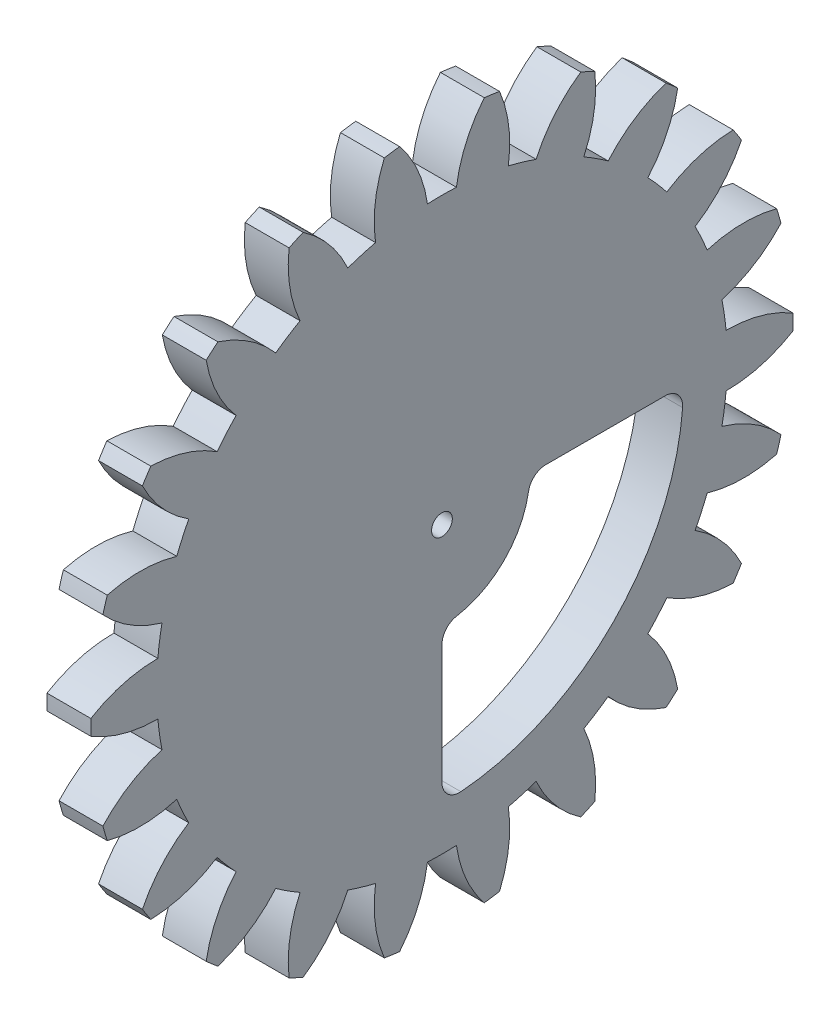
SolidWorks part; units mm, degrees
ref_plane "Plane1" through (0, 0, 0) normal (0, 0, 1) x (1, 0, 0)
ref_plane "Plane2" through (0, 0, 0) normal (0, 1, 0) x (1, 0, 0)
ref_plane "Plane3" through (0, 0, 0) normal (1, 0, 0) x (0, 0, -1)
sketch "HoldingSke" plane through (0, 0, 0) normal (0, 1, 0) x (1, 0, 0)
  line L0 (0, 0) -> (141.3028, -57.09)
  line L1 (-15, 0) -> (100, 0) construction
  line L2 (0, 0) -> (-2.1039, 2.3779)
  line L3 (0, 0) -> (-11.863, 4.5341)
  line L4 (0, 0) -> (8.0072, 3.2351)
  line L5 (0, 0) -> (-47.5972, -17.7524)
  line L6 (0, 0) -> (-5.2639, -3.5516)
  line L7 (-2.1039, 2.3779) -> (8.8309, 51.9877)
  line L8 (-76.2, 54.61) -> (-69.596, 54.61)
  line L9 (-71.009, 38.7566) -> (-53.1078, 45.2721)
  line L10 (-76.2, 71.12) -> (104.1128, 71.12)
  line L11 (0, 0) -> (-6.35, 0)
  line L12 (-76.2, 101.6) -> (-76.0298, 101.6)
  line L13 (24.9733, 27.94) -> (52.9518, 28.4284)
  line L14 (24.9733, 27.94) -> (24.9746, 27.94)
  line L15 (24.9733, 27.94) -> (100.4006, 29.5858)
  circle A0 centre (0, 0) radius 3.175
  circle A1 centre (0, 0) radius 38.1
  circle A2 centre (0, 0) radius 38.1
  circle A3 centre (0, 0) radius 3.175
  dimension "MHD" = 76.2
  dimension "Hub_dia" = 76.2
  dimension "Bore" = 6.35
  dimension "MBD" = 6.35
  dimension "Num_teeth" = 22
  dimension "Pitch_radius" = 180.3128
  dimension "Pitch" = 152.4
  dimension "Width" = 6.35
  dimension "Overall_len" = 50.8
  dimension "Show_teeth" = 22
  dimension "Thickness" = 6.35
  dimension "OAL" = 50.8006
  dimension "T_dim" = 6.604
  dimension "Ap" = 20
  dimension "H" = 19.05
  dimension "Backlash" = 0.1702
  dimension "Addendum_fac" = 1
  dimension "Dedendum_fac" = 1.25
  dimension "Clearance_fac" = 0.25
  dimension "Dedendum_add" = 0.0013
sketch "BasProSke" plane through (0, 0, 0) normal (0, 1, 0) x (1, 0, 0)
  line L0 (-10, 0) -> (60, 0) construction
  line L1 (0, 0) -> (0, 50.8)
  line L2 (0, 0) -> (6.35, 0)
  line L3 (6.35, 0) -> (6.35, 50.8)
  line L4 (6.35, 50.8) -> (0, 50.8)
  dimension "Diameter" = 101.6
  dimension "Thickness" = 6.35
revolve "Base-Revolve" add sketch "BasProSke" angle 360 about L0
sketch "TooCutSke" plane through (0, 0, 0) normal (1, 0, 0) x (0, 0, -1)
  line L1 (0, 0) -> (0, 107) construction
  line L2 (0, 0) -> (-3.6197, 46.4258) construction
  line L3 (0, 0) -> (-13.2263, 91.9908) construction
  line L4 (-3.6197, 46.4258) -> (-6.6131, 45.9954) construction
  arc A0 (2.0934, 41.2206) -> (-2.0934, 41.2206) centre (0, 0) ccw
  arc A1 (6.1404, 50.4531) -> (-6.1404, 50.4531) centre (0, 0) ccw
  circle A2 centre (0, 0) radius 46.5667 construction
  circle A3 centre (0, 0) radius 43.7584 construction
  arc A4 (-2.0934, 41.2206) -> (-6.1404, 50.4531) centre (-20.5402, 38.638) ccw
  arc A5 (6.1404, 50.4531) -> (2.0934, 41.2206) centre (20.5402, 38.638) ccw
  dimension "Root_dia" = 82.5475
  dimension "Overcut_dia" = 101.6508
  dimension "Pitch_dia" = 93.1333
  dimension "Base_dia" = 87.5167
  dimension "Flank_rad" = 18.6267
  dimension "Half_ang" = 8.182
  dimension "Half_CT" = 3.0242
extrude "ToothCut" cut sketch "TooCutSke" along normal through all
fillet "Breaks" [suppressed] radius 0.0847
fillet "RootFillets" [suppressed] radius 1.0596
pattern_circular "TeethCuts" count 22 every 16.364 about axis through (-10, 0, 0) along (1, 0, 0) of "ToothCut", "RootFillets", "Breaks"
sketch "HubNeaOneSke" plane through (0, 0, 0) normal (-1, 0, 0) x (0, 0, 1)
  circle A0 centre (0, 0) radius 38.1
  dimension "Diameter" = 76.2
extrude "HubNearOne" [suppressed] add sketch "HubNeaOneSke" along normal blind 44.4506
sketch "HubNeaBotSke" plane through (0, 0, 0) normal (-1, 0, 0) x (0, 0, 1)
  circle A0 centre (0, 0) radius 38.1
  dimension "Diameter" = 76.2
extrude "HubNearBoth" [suppressed] add sketch "HubNeaBotSke" along normal blind 22.2253
ref_plane "FarPln" through (6.35, 0, 0) normal (1, 0, 0) x (0, 0, -1)
sketch "HubFarSke" plane through (6.35, 0, 0) normal (1, 0, 0) x (0, 0, -1)
  circle A0 centre (0, 0) radius 38.1
  dimension "Diameter" = 76.2
extrude "HubFar" [suppressed] add sketch "HubFarSke" along normal blind 22.2253
sketch "BorSke" plane through (0, 0, 0) normal (1, 0, 0) x (0, 0, -1)
  circle A0 centre (0, 0) radius 3.175
  dimension "Diameter" = 6.35
extrude "Bore" cut sketch "BorSke" along normal mid plane 101.6012
sketch "KeySke" plane through (0, 0, 0) normal (1, 0, 0) x (0, 0, -1)
  line L0 (-0.127, 0) -> (-0.127, 3.429)
  line L1 (-0.127, 3.429) -> (0.127, 3.429)
  line L2 (0.127, 3.429) -> (0.127, 0)
  line L3 (0, 0) -> (0, 34) construction
  line L4 (-0.127, 0) -> (0.127, 0)
  dimension "Offset" = 3.429
  dimension "Width" = 0.254
extrude "Keyway" [suppressed] cut sketch "KeySke" along normal mid plane 101.6012
pattern_circular "Keyway2" [suppressed] count 2 every 90 about axis through (-10, 0, 0) along (1, 0, 0)
sketch "Sketch1" plane through (6.35, 0, 0) normal (1, 0, 0) x (0, 0, -1)
  circle A0 centre (0, 0) radius 3.175
  circle A1 centre (0, 0) radius 3.175 construction
  circle A2 centre (0, 0) radius 1.5
  dimension "D1" = 3
extrude "Boss-Extrude1" add sketch "Sketch1" against normal up to surface (6.35 mm away)
sketch "Sketch2" plane through (6.35, 0, 0) normal (1, 0, 0) x (0, 0, -1)
  line L0 (0, -12.7) -> (0, -34.925)
  line L1 (12.7, 0) -> (34.925, 0)
  circle A0 centre (0, 0) radius 12.7 construction
  circle A1 centre (0, 0) radius 34.925 construction
  arc A2 (0, -12.7) -> (12.7, 0) centre (0, 0) ccw
  arc A3 (0, -34.925) -> (34.925, 0) centre (0, 0) ccw
  dimension "D1" = 69.85
  dimension "D2" = 25.4
extrude "Cut-Extrude1" cut sketch "Sketch2" against normal through all
fillet "Fillet1" radius 2.54 4 edges at (3.175, -34.925, 0) (3.175, 0, -34.925) (3.175, 0, -12.7) (3.175, -12.7, 0)
equation "' \"Pitch@HoldingSke\" = 4"
equation "' \"Num_teeth@HoldingSke\" = 12"
equation "' \"Ap@HoldingSke\" =  20"
equation "' \"Width@HoldingSke\" = 0.5"
equation "' \"Hub_dia@HoldingSke\"= 1"
equation "' \"Overall_len@HoldingSke\" = 1.0"
equation "'\"Bore@HoldingSke\" = 0.75"
equation "' \"T_dim@HoldingSke\" = 0.85"
equation "' \"Width@KeySke\" = 0.25"
equation "' \"Show_teeth@HoldingSke\" = 13"
equation "' \"Backlash@HoldingSke\" = 0.009"
equation "' \"Addendum_fac@HoldingSke\" = 1.0"
equation "' \"Dedendum_fac@HoldingSke\" = 1.25"
equation "' \"Dedendum_add@HoldingSke\" = 0.00005"
equation "' \"Clearance_fac@HoldingSke\" = 0.25"
equation "' \"Pitch@HoldingSke\" = 0.5"
equation "' \"Num_teeth@HoldingSke\" = 23"
equation "' \"Bore@HoldingSke\" = 0.75"
equation "' \"Show_teeth@HoldingSke\" = 23"
equation "' \"Backlash@HoldingSke\" = 0.0375"
equation "\"Overcut_dia@TooCutSke\" = (\"Num_teeth@HoldingSke\" + 2 * \"Addendum_fac@HoldingSke\") / \"Pitch@HoldingSke\" + 0.002"
equation "\"Pitch_dia@TooCutSke\" = \"Num_teeth@HoldingSke\" / \"Pitch@HoldingSke\""
equation "\"Base_dia@TooCutSke\" = \"Num_teeth@HoldingSke\" / \"Pitch@HoldingSke\" * cos((\"Ap@HoldingSke\"  * 3.14159265 / 180))"
equation "\"Root_dia@TooCutSke\" = (\"Num_teeth@HoldingSke\" + 2) / \"Pitch@HoldingSke\" - 2 * (\"Addendum_fac@HoldingSke\" + \"Dedendum_fac@HoldingSke\") / \"Pitch@HoldingSke\" - \"Dedendum_add@HoldingSke\" * 2"
equation "\"Half_ang@TooCutSke\" = 180 / \"Num_teeth@HoldingSke\""
equation "\"Half_CT@TooCutSke\" = \"Num_teeth@HoldingSke\" / \"Pitch@HoldingSke\" * sin((3.14159265 / 2 / \"Num_teeth@HoldingSke\")) / 2 - 7 * \"Backlash@HoldingSke\" / 4"
equation "\"Flank_rad@TooCutSke\" = \"Num_teeth@HoldingSke\" / \"Pitch@HoldingSke\" / 5"
equation "\"Radius@RootFillets\" = \"Clearance_fac@HoldingSke\" / \"Pitch@HoldingSke\" + \"Dedendum_add@HoldingSke\""
equation "\"Break_rad@Breaks\" = 0.02 / \"Pitch@HoldingSke\""
equation "\"Thickness@HoldingSke\" = \"Width@HoldingSke\""
equation "\"OAL@HoldingSke\" = \"Thickness@HoldingSke\""
equation "\"MHD@HoldingSke\" = (\"Num_teeth@HoldingSke\" + 2) / \"Pitch@HoldingSke\" - 2 * (\"Addendum_fac@HoldingSke\" + \"Dedendum_fac@HoldingSke\")  / \"Pitch@HoldingSke\" - \"Dedendum_add@HoldingSke\" * 2"
equation "\"MBD@HoldingSke\" = (\"Num_teeth@HoldingSke\" + 2) / \"Pitch@HoldingSke\" - 2 * (\"Addendum_fac@HoldingSke\" + \"Dedendum_fac@HoldingSke\")  / \"Pitch@HoldingSke\" - \"Dedendum_add@HoldingSke\" * 2 - 0.002"
equation "\"MHD@HoldingSke\" = ((sgn( \"MHD@HoldingSke\" - \"Hub_dia@HoldingSke\" )-1)*( \"MHD@HoldingSke\" - \"Hub_dia@HoldingSke\" ))/-2+ \"Hub_dia@HoldingSke\""
equation "\"MBD@HoldingSke\" = ((sgn( \"MBD@HoldingSke\" - \"Bore@HoldingSke\" )-1)*( \"MBD@HoldingSke\" - \"Bore@HoldingSke\" ))/-2+ \"Bore@HoldingSke\""
equation "\"OAL@HoldingSke\" = ((sgn( \"OAL@HoldingSke\" - \"Overall_len@HoldingSke\" )+1)*( \"OAL@HoldingSke\" - \"Overall_len@HoldingSke\" ))/2 + \"Overall_len@HoldingSke\" + 0.000002"
equation "\"Num_teeth@TeethCuts\" = int( \"Show_teeth@HoldingSke\" ) + 1"
equation "\"Num_teeth@TeethCuts\" = ((sgn( \"Num_teeth@TeethCuts\" - \"Num_teeth@HoldingSke\" )-1)*( \"Num_teeth@TeethCuts\" - \"Num_teeth@HoldingSke\" ))/-2+ \"Num_teeth@HoldingSke\""
equation "\"Num_teeth@TeethCuts\" = ((sgn( \"Num_teeth@TeethCuts\" - 2.0)+1)*( \"Num_teeth@TeethCuts\" - 2.0))/2 +2.0"
equation "\"Angle@TeethCuts\" = 360.0 / \"Num_teeth@HoldingSke\""
equation "\"Diameter@BasProSke\" = (\"Num_teeth@HoldingSke\" + 2 * \"Addendum_fac@HoldingSke\") / \"Pitch@HoldingSke\""
equation "\"Thickness@BasProSke\"  = \"Thickness@HoldingSke\""
equation "' \"Fillet_rad@BasProSke\" =  \"Thickness@HoldingSke\" * 0.05"
equation "\"MHD@HoldingSke\" = ((sgn( \"MHD@HoldingSke\" - \"Root_dia@TooCutSke\" )-1)*( \"MHD@HoldingSke\" - \"Root_dia@TooCutSke\" ))/-2+ \"Root_dia@TooCutSke\""
equation "\"Diameter@HubNeaOneSke\" = \"MHD@HoldingSke\""
equation "\"Length@HubNearOne\" = \"OAL@HoldingSke\" - \"Thickness@BasProSke\""
equation "\"Diameter@HubNeaBotSke\" = \"MHD@HoldingSke\""
equation "\"Length@HubNearBoth\" = ( \"OAL@HoldingSke\" - \"Thickness@BasProSke\" ) / 2.0"
equation "\"Thickness@FarPln\" = \"Thickness@BasProSke\""
equation "\"Diameter@HubFarSke\" = \"MHD@HoldingSke\""
equation "\"Length@HubFar\" = ( \"OAL@HoldingSke\" - \"Thickness@BasProSke\" ) / 2.0"
equation "\"Diameter@BorSke\" = \"MBD@HoldingSke\""
equation "\"D1@Bore\" = \"OAL@HoldingSke\" * 2.0"
equation "\"D1@Keyway\" = \"OAL@HoldingSke\" * 2.0"
equation "\"Offset@KeySke\" = \"T_dim@HoldingSke\" - \"MBD@HoldingSke\" / 2.0"
